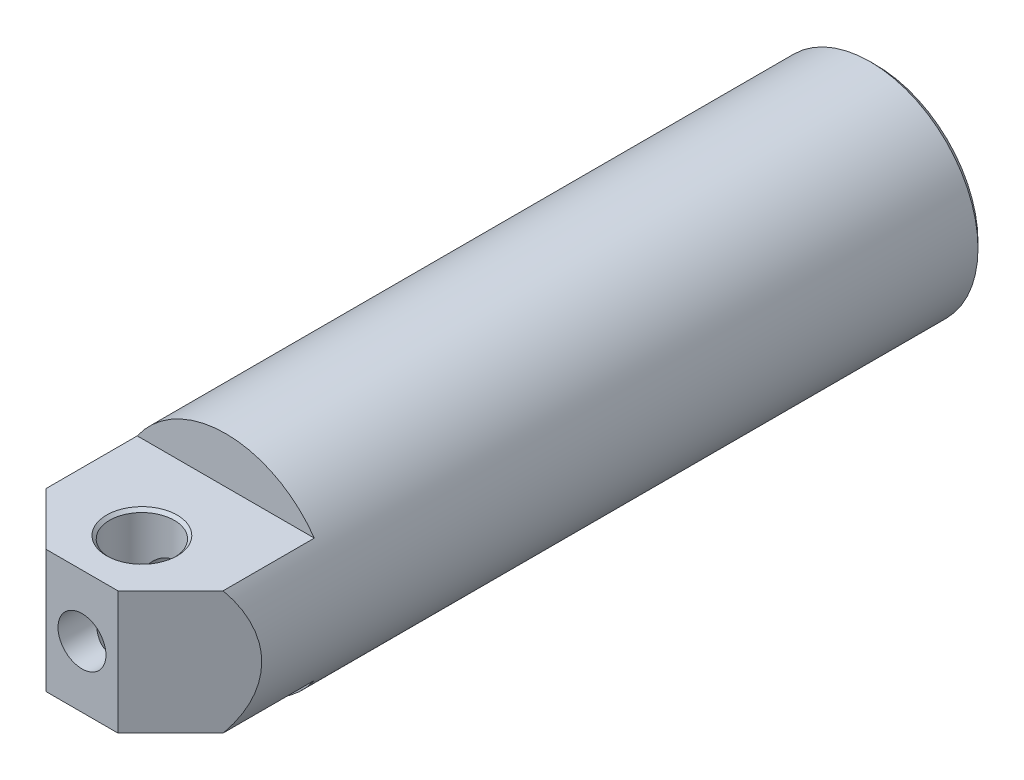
SolidWorks part; units mm, degrees
ref_plane "Front Plane" through (0, 0, 0) normal (0, 0, 1) x (1, 0, 0)
ref_plane "Top Plane" through (0, 0, 0) normal (0, 1, 0) x (1, 0, 0)
ref_plane "Right Plane" through (0, 0, 0) normal (1, 0, 0) x (0, 0, -1)
sketch "Sketch1" plane through (0, 0, 0) normal (1, 0, 0) x (0, 0, -1)
  line L0 (0, 0) -> (98.752, 0) construction
  line L3 (108.775, 22.225) -> (199.7583, 22.225)
  line L4 (210.375, 22.225) -> (210.375, 28.575)
  line L6 (0, 28.575) -> (0, 0)
  line L7 (206.565, 22.225) -> (206.565, 23.5966)
  line L8 (206.565, 23.5966) -> (204.787, 23.5966)
  line L10 (210.375, 28.575) -> (0, 28.575)
  line L11 (204.787, 23.5966) -> (204.787, 22.225)
  line L12 (206.565, 22.225) -> (210.375, 22.225)
  line L13 (44.45, 19.05) -> (108.775, 19.05)
  line L14 (44.45, 9.525) -> (38.7268, 0)
  line L15 (38.7268, 0) -> (0, 0)
  line L16 (108.775, 19.05) -> (108.775, 22.225)
  line L17 (44.45, 9.525) -> (44.45, 19.05)
  line L18 (200.787, 22.225) -> (200.787, 22.9489)
  line L19 (200.787, 22.9489) -> (199.7583, 22.9489)
  line L20 (199.7583, 22.9489) -> (199.7583, 22.225)
  line L21 (200.787, 22.225) -> (204.787, 22.225)
  line L22 (199.7583, 22.9489) -> (199.7583, 19.9517) construction
  dimension "D3" = 44.45
  dimension "D4" = 57.15
  dimension "D5" = 210.375
  dimension "D6" = 47.1932
  dimension "D7" = 1.778
  dimension "D10" = 3.81
  dimension "D11" = 59
  dimension "D12" = 165.925
  dimension "D13" = 101.6
  dimension "D14" = 38.1
  dimension "D15" = 9.525
  dimension "D16" = 45.8978
  dimension "D17" = 1.0287
  dimension "D18" = 4
  dimension "D19" = 2.9972
  dimension "D20" = 39.9034
revolve "Revolve1" add sketch "Sketch1" angle 360 about L0
sketch "Sketch2" plane through (0, 0, 0) normal (0, 0, 1) x (1, 0, 0)
  line L1 (-28.575, 16.323) -> (28.575, 16.323)
  line L2 (-28.575, 16.323) -> (-28.575, -16.323)
  line L3 (-28.575, -16.323) -> (28.575, -16.323)
  line L4 (28.575, 16.323) -> (28.575, -16.323)
  line L5 (-28.575, 16.323) -> (28.575, -16.323) construction
  line L6 (-28.575, -16.323) -> (28.575, 16.323) construction
  circle A1 centre (0, 0) radius 28.575 construction
  point P0 (0, 0)
  dimension "D1" = 32.646
extrude "Cut-Extrude1" cut sketch "Sketch2" against normal blind 38.1 flip side to cut
sketch "Sketch3" plane through (0, 16.323, 0) normal (0, 1, 0) x (1, 0, 0)
  line L0 (23.454, 0) -> (-23.454, 0) construction
  circle A0 centre (0, 15.875) radius 8.5635
  dimension "D1" = 17.127
  dimension "D3" = 15.875
extrude "Cut-Extrude2" cut sketch "Sketch3" against normal through all
sketch "Sketch4" plane through (0, 16.323, 0) normal (0, 1, 0) x (1, 0, 0)
  line L0 (-28.575, 0) -> (-9.525, 0)
  line L1 (-9.525, 0) -> (-28.575, 19.05)
  line L2 (-28.575, 19.05) -> (-28.575, 0)
  line L3 (23.454, 0) -> (-23.454, 0) construction
  line L5 (0, 0) -> (0, 62.0371) construction
  line L6 (23.454, 0) -> (-23.454, 0) construction
  line L7 (28.575, 19.05) -> (28.575, 0)
  line L8 (9.525, 0) -> (28.575, 19.05)
  line L9 (28.575, 0) -> (9.525, 0)
  line L10 (-28.575, 210.375) -> (-28.575, 0) construction
  dimension "D1" = 45
  dimension "D2" = 19.05
extrude "Cut-Extrude3" cut sketch "Sketch4" against normal through all
sketch "Sketch5" plane through (0, 0, 0) normal (0, 1, 0) x (1, 0, 0)
  line L1 (-4.0635, 121.475) -> (4.0635, 121.475) construction
  line L2 (-4.0635, 121.475) -> (-4.0635, 169.1)
  line L3 (-4.0635, 169.1) -> (4.0635, 169.1) construction
  line L4 (4.0635, 121.475) -> (4.0635, 169.1)
  line L5 (28.575, 210.375) -> (-28.575, 210.375) construction
  arc A0 (-4.0635, 169.1) -> (4.0635, 169.1) centre (0, 169.1) cw
  arc A1 (4.0635, 121.475) -> (-4.0635, 121.475) centre (0, 121.475) cw
  dimension "D1" = 47.625
  dimension "D2" = 41.275
  dimension "D3" = 8.127
extrude "Cut-Extrude4" cut sketch "Sketch5" against normal through all
chamfer "Chamfer1" distance 1.5875 angle 45 1 edges at (28.575, 0, -210.375)
chamfer "Chamfer2" distance 1.5875 angle 30 1 edges at (19.05, 0, -108.775)
chamfer "Chamfer3" distance 0.7937 angle 45 2 edges at (0, 16.323, -7.3115) (0, -16.323, -24.4385)
sketch "Sketch6" plane through (0, 0, 0) normal (0, 0, 1) x (1, 0, 0)
  circle A0 centre (0, 0) radius 6.35
  dimension "D1" = 12.7
extrude "Cut-Extrude5" cut sketch "Sketch6" against normal through all
chamfer "Chamfer4" distance 1.5875 angle 45 1 edges at (22.225, 0, -210.375)
